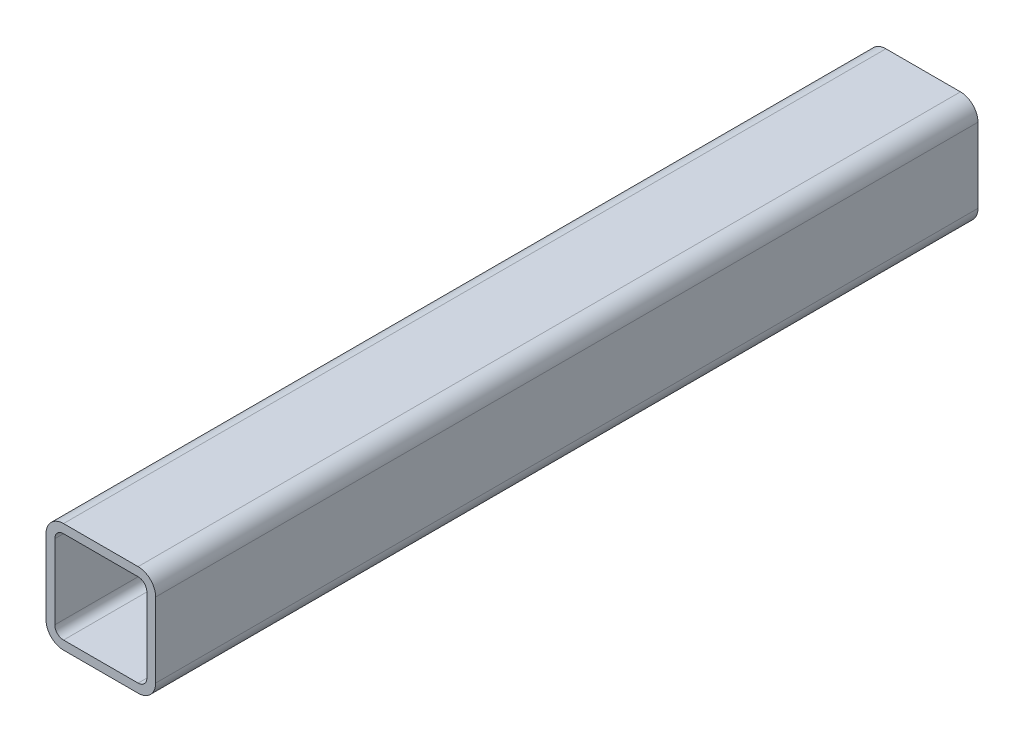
SolidWorks part; units mm, degrees
ref_plane "Front" through (0, 0, 0) normal (0, 0, 1) x (1, 0, 0)
ref_plane "Top" through (0, 0, 0) normal (0, 1, 0) x (1, 0, 0)
ref_plane "Right" through (0, 0, 0) normal (1, 0, 0) x (0, 0, -1)
sketch "Sketch2" plane through (0, 0, 0) normal (0, 0, 1) x (1, 0, 0)
  line L1 (-34, 50) -> (34, 50)
  line L2 (-50, 34) -> (-50, -34)
  line L3 (-34, -50) -> (34, -50)
  line L4 (50, 34) -> (50, -34)
  line L5 (-50, 50) -> (50, -50) construction
  line L6 (-50, -50) -> (50, 50) construction
  arc A0 (-34, 50) -> (-50, 34) centre (-34, 34) ccw
  arc A1 (34, 50) -> (50, 34) centre (34, 34) cw
  arc A2 (34, -50) -> (50, -34) centre (34, -34) ccw
  arc A3 (-50, -34) -> (-34, -50) centre (-34, -34) ccw
  point P0 (0, 0)
  dimension "Rad" = 16
  dimension "Width" = 100
  dimension "Height" = 100
extrude "Extrude-Thin1" add sketch "Sketch2" along normal mid plane 750 thin
equation "\"Rad@Sketch2\" = \"Thickness@Extrude-Thin1\"*2"
